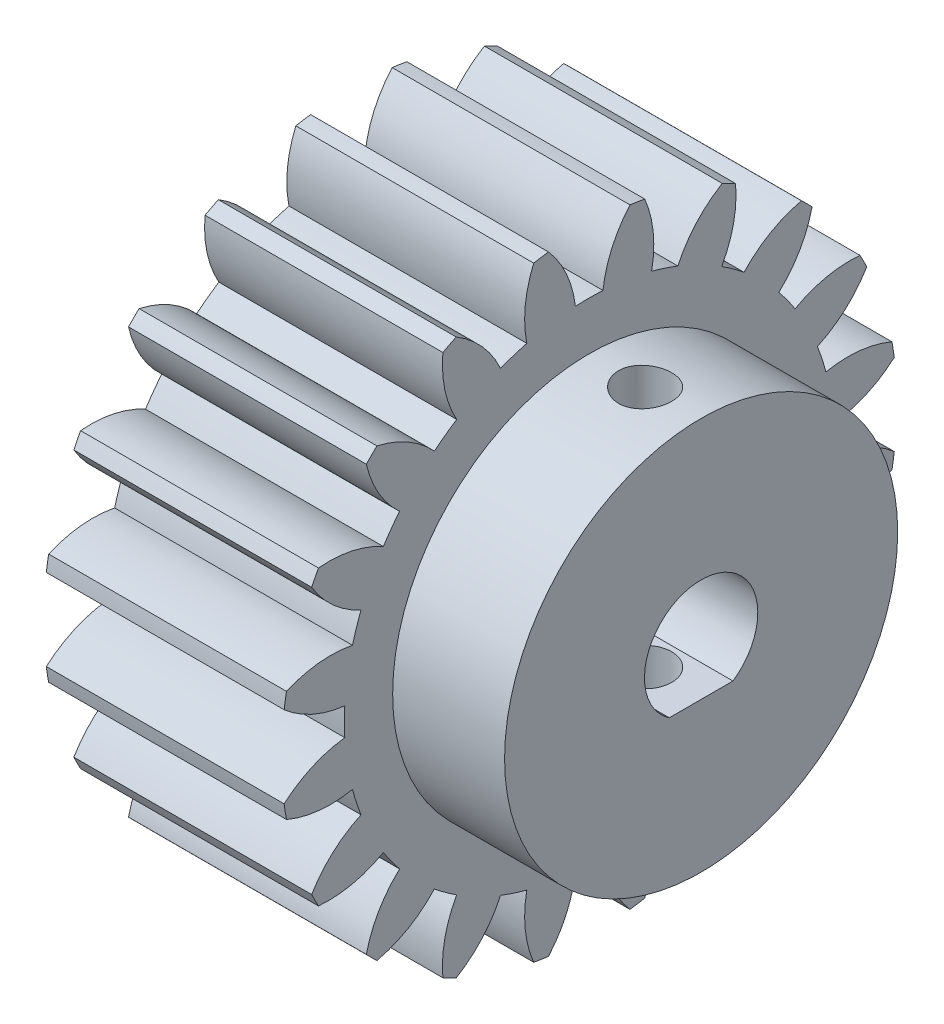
SolidWorks part; units mm, degrees
ref_plane "Plane1" through (0, 0, 0) normal (0, 0, 1) x (1, 0, 0)
ref_plane "Plane2" through (0, 0, 0) normal (0, 1, 0) x (1, 0, 0)
ref_plane "Plane3" through (0, 0, 0) normal (1, 0, 0) x (0, 0, -1)
other "Configuration Table"
sketch "HoldingSke" plane through (0, 0, 0) normal (0, 1, 0) x (1, 0, 0)
  line L0 (0, 0) -> (0.4698, -0.171)
  line L1 (-15, 0) -> (100, 0) construction
  line L2 (0, 0) -> (-2.1039, 2.3779)
  line L3 (0, 0) -> (-11.863, 4.5341)
  line L4 (0, 0) -> (8.1152, 2.9537)
  line L5 (0, 0) -> (-46.8476, -17.4728)
  line L6 (0, 0) -> (-14.0924, -9.5082)
  line L7 (-2.1039, 2.3779) -> (8.6586, 51.2059)
  line L8 (-76.2, 54.61) -> (-76.1, 54.61)
  line L9 (-71.009, 38.7566) -> (-53.1078, 45.2721)
  line L10 (-76.2, 71.12) -> (104.1128, 71.12)
  line L11 (0, 0) -> (-17, 0)
  line L12 (-76.2, 101.6) -> (-76.133, 101.6)
  line L13 (24.9733, 27.94) -> (52.9518, 28.4284)
  line L14 (24.9733, 27.94) -> (24.9743, 27.94)
  line L15 (24.9733, 27.94) -> (100.4006, 29.5858)
  line L16 (-63.627, -2) -> (-12.827, -2)
  circle A0 centre (0, 0) radius 0.4
  circle A1 centre (0, 0) radius 17.499
  circle A2 centre (0, 0) radius 37.5
  circle A3 centre (0, 0) radius 0.4
sketch "BasProSke" plane through (0, 0, 0) normal (0, 1, 0) x (1, 0, 0)
  line L0 (-10, 0) -> (60, 0) construction
  line L1 (0, 0) -> (0, 22)
  line L2 (0, 0) -> (17, 0)
  line L3 (17, 0) -> (17, 22)
  line L4 (17, 22) -> (0, 22)
revolve "Base-Revolve" add sketch "BasProSke" angle 360 about L0
sketch "TooCutSke" plane through (0, 0, 0) normal (1, 0, 0) x (0, 0, -1)
  line L1 (0, 0) -> (0, 107) construction
  line L2 (0, 0) -> (-1.6864, 19.9288) construction
  line L3 (0, 0) -> (-6.2409, 39.4033) construction
  line L4 (-1.6864, 19.9288) -> (-3.1204, 19.7016) construction
  arc A0 (0.9862, 17.4712) -> (-0.9862, 17.4712) centre (0, 0) ccw
  arc A1 (2.9329, 21.8293) -> (-2.9329, 21.8293) centre (0, 0) ccw
  circle A2 centre (0, 0) radius 20 construction
  circle A3 centre (0, 0) radius 18.7939 construction
  arc A4 (-0.9862, 17.4712) -> (-2.9329, 21.8293) centre (-8.9313, 16.536) ccw
  arc A5 (2.9329, 21.8293) -> (0.9862, 17.4712) centre (8.9313, 16.536) ccw
extrude "ToothCut" cut sketch "TooCutSke" along normal through all
fillet "Breaks" [suppressed] radius 0.04
fillet "RootFillets" [suppressed] radius 0.501
pattern_circular "TeethCuts" count 20 every 18 about axis through (-10, 0, 0) along (1, 0, 0) of "ToothCut", "RootFillets", "Breaks"
sketch "HubNeaOneSke" plane through (0, 0, 0) normal (-1, 0, 0) x (0, 0, 1)
  circle A0 centre (0, 0) radius 17.499
extrude "HubNearOne" [suppressed] add sketch "HubNeaOneSke" along normal blind 33.0001
sketch "HubNeaBotSke" plane through (0, 0, 0) normal (-1, 0, 0) x (0, 0, 1)
  circle A0 centre (0, 0) radius 17.499
extrude "HubNearBoth" [suppressed] add sketch "HubNeaBotSke" along normal blind 16.5
ref_plane "FarPln" through (17, 0, 0) normal (1, 0, 0) x (0, 0, -1)
sketch "HubFarSke" plane through (17, 0, 0) normal (1, 0, 0) x (0, 0, -1)
  circle A0 centre (0, 0) radius 17.499
extrude "HubFar" [suppressed] add sketch "HubFarSke" along normal blind 16.5
sketch "BorSke" plane through (0, 0, 0) normal (1, 0, 0) x (0, 0, -1)
  circle A0 centre (0, 0) radius 0.4
extrude "Bore" cut sketch "BorSke" along normal mid plane 100.0001
sketch "KeySke" plane through (0, 0, 0) normal (1, 0, 0) x (0, 0, -1)
  line L0 (-0.05, 0) -> (-0.05, 0.5)
  line L1 (-0.05, 0.5) -> (0.05, 0.5)
  line L2 (0.05, 0.5) -> (0.05, 0)
  line L3 (0, 0) -> (0, 34) construction
  line L4 (-0.05, 0) -> (0.05, 0)
extrude "Keyway" [suppressed] cut sketch "KeySke" along normal mid plane 100.0001
pattern_circular "Keyway2" [suppressed] count 2 every 90 about axis through (-10, 0, 0) along (1, 0, 0)
sketch "Croquis1" plane through (17, 0, 0) normal (1, 0, 0) x (0, 0, -1)
  line L0 (-2.276, -3.35) -> (2.276, -3.35)
  arc A0 (2.276, -3.35) -> (-2.276, -3.35) centre (0, 0) ccw
  point P5 (0, 4.05)
  dimension "D1" = 8.1
  dimension "D2" = 7.4
sketch "Croquis2" plane through (0, 0, 0) normal (-1, 0, 0) x (0, 0, 1)
  circle A0 centre (0, 0) radius 0.4
  circle A1 centre (0, 0) radius 0.4 construction
sketch "Croquis3" plane through (17, 0, 0) normal (1, 0, 0) x (0, 0, -1)
  line L0 (-2.276, -3.35) -> (2.276, -3.35) construction
  line L1 (-2.276, -3.35) -> (2.276, -3.35)
  circle A2 centre (0, 0) radius 14.05
  arc A3 (2.276, -3.35) -> (-2.276, -3.35) centre (0, 0) ccw construction
  arc A4 (2.276, -3.35) -> (-2.276, -3.35) centre (0, 0) ccw
  dimension "D1" = 28.1
extrude "Saliente-Extruir2" add sketch "Croquis3" along normal blind 8
sketch "Croquis4" plane through (0, 0, 0) normal (0, 1, 0) x (1, 0, 0)
  line L0 (0, 0) -> (25, 0) construction
  line L1 (0, 0.9862) -> (0, -0.9862) construction
  line L2 (25, -14.05) -> (25, 14.05) construction
  circle A0 centre (21, 0) radius 1.9
  dimension "D1" = 3.8
  dimension "D2" = 4
extrude "Cortar-Extruir2" cut sketch "Croquis4" against normal through all and the other way through all
extrude "Cortar-Extruir3" cut sketch "Croquis1" against normal blind 10 contours A0 L0
equation "' \"Module@HoldingSke\" = 6.35"
equation "' \"Num_teeth@HoldingSke\" = 12"
equation "' \"Ap@HoldingSke\" =  20"
equation "' \"Ap@HoldingSke\" = 20"
equation "' \"Width@HoldingSke\" = 0.5 * 25.4"
equation "' \"Hub_dia@HoldingSke\"= 1 * 25.4"
equation "' \"Hub_dia@HoldingSke\" = 1 * 25.4"
equation "' \"Overall_len@HoldingSke\" = 1.0 * 25.4"
equation "' \"Bore@HoldingSke\" = 0.75 * 25.4"
equation "' \"T_dim@HoldingSke\" = 0.1 * 25.4"
equation "' \"Width@KeySke\" = 0.25 * 25.4"
equation "' \"Show_teeth@HoldingSke\" = 13"
equation "' \"Backlash@HoldingSke\" = 0.009 * 25.4"
equation "' \"Addendum_fac@HoldingSke\" = 1.0"
equation "' \"Dedendum_fac@HoldingSke\" = 1.25"
equation "' \"Dedendum_add@HoldingSke\" = 0.00005 * 25.4"
equation "' \"Clearance_fac@HoldingSke\" = 0.25"
equation "\"Pitch@HoldingSke\" = 1 / \"Module@HoldingSke\""
equation "\"Overcut_dia@TooCutSke\" = (\"Num_teeth@HoldingSke\" + 2 * \"Addendum_fac@HoldingSke\") / \"Pitch@HoldingSke\" + 0.002 * 25.4"
equation "\"Pitch_dia@TooCutSke\" = \"Num_teeth@HoldingSke\" / \"Pitch@HoldingSke\""
equation "\"Base_dia@TooCutSke\" = \"Num_teeth@HoldingSke\" / \"Pitch@HoldingSke\" * cos((\"Ap@HoldingSke\"  * 3.14159265 / 180))"
equation "\"Root_dia@TooCutSke\" = (\"Num_teeth@HoldingSke\" + 2) / \"Pitch@HoldingSke\" - 2 * (\"Addendum_fac@HoldingSke\" + \"Dedendum_fac@HoldingSke\") / \"Pitch@HoldingSke\" - \"Dedendum_add@HoldingSke\" * 2"
equation "\"Half_ang@TooCutSke\" = 180 / \"Num_teeth@HoldingSke\""
equation "\"Half_CT@TooCutSke\" = \"Num_teeth@HoldingSke\" / \"Pitch@HoldingSke\" * sin((3.14159265 / 2 / \"Num_teeth@HoldingSke\")) / 2 - 7 * \"Backlash@HoldingSke\" / 4"
equation "\"Flank_rad@TooCutSke\" = \"Num_teeth@HoldingSke\" / \"Pitch@HoldingSke\" / 5"
equation "\"Radius@RootFillets\" = \"Clearance_fac@HoldingSke\" / \"Pitch@HoldingSke\" + \"Dedendum_add@HoldingSke\""
equation "\"Break_rad@Breaks\" = 0.02 / \"Pitch@HoldingSke\""
equation "\"Thickness@HoldingSke\" = \"Width@HoldingSke\""
equation "\"OAL@HoldingSke\" = \"Thickness@HoldingSke\""
equation "\"MHD@HoldingSke\" = (\"Num_teeth@HoldingSke\" + 2) / \"Pitch@HoldingSke\" - 2 * (\"Addendum_fac@HoldingSke\" + \"Dedendum_fac@HoldingSke\")  / \"Pitch@HoldingSke\" - \"Dedendum_add@HoldingSke\" * 2"
equation "\"MBD@HoldingSke\" = (\"Num_teeth@HoldingSke\" + 2) / \"Pitch@HoldingSke\" - 2 * (\"Addendum_fac@HoldingSke\" + \"Dedendum_fac@HoldingSke\")  / \"Pitch@HoldingSke\" - \"Dedendum_add@HoldingSke\" * 2 - 0.002 * 25.4"
equation "\"MHD@HoldingSke\" = ((sgn( \"MHD@HoldingSke\" - \"Hub_dia@HoldingSke\" )-1)*( \"MHD@HoldingSke\" - \"Hub_dia@HoldingSke\" ))/-2+ \"Hub_dia@HoldingSke\""
equation "\"MBD@HoldingSke\" = ((sgn( \"MBD@HoldingSke\" - \"Bore@HoldingSke\" )-1)*( \"MBD@HoldingSke\" - \"Bore@HoldingSke\" ))/-2+ \"Bore@HoldingSke\""
equation "\"OAL@HoldingSke\" = ((sgn( \"OAL@HoldingSke\" - \"Overall_len@HoldingSke\" )+1)*( \"OAL@HoldingSke\" - \"Overall_len@HoldingSke\" ))/2 + \"Overall_len@HoldingSke\" + 0.000002 * 25.4"
equation "\"Num_teeth@TeethCuts\" = int( \"Show_teeth@HoldingSke\" ) + 1"
equation "\"Num_teeth@TeethCuts\" = ((sgn( \"Num_teeth@TeethCuts\" - \"Num_teeth@HoldingSke\" )-1)*( \"Num_teeth@TeethCuts\" - \"Num_teeth@HoldingSke\" ))/-2+ \"Num_teeth@HoldingSke\""
equation "\"Num_teeth@TeethCuts\" = ((sgn( \"Num_teeth@TeethCuts\" - 2.0)+1)*( \"Num_teeth@TeethCuts\" - 2.0))/2 +2.0"
equation "\"Angle@TeethCuts\" = 360.0 / \"Num_teeth@HoldingSke\""
equation "\"Diameter@BasProSke\" = (\"Num_teeth@HoldingSke\" + 2 * \"Addendum_fac@HoldingSke\") / \"Pitch@HoldingSke\""
equation "\"Thickness@BasProSke\"  = \"Thickness@HoldingSke\""
equation "' \"Fillet_rad@BasProSke\" =  \"Thickness@HoldingSke\" * 0.05"
equation "' \"Fillet_rad@BasProSke\" = \"Thickness@HoldingSke\" * 0.05"
equation "\"MHD@HoldingSke\" = ((sgn( \"MHD@HoldingSke\" - \"Root_dia@TooCutSke\" )-1)*( \"MHD@HoldingSke\" - \"Root_dia@TooCutSke\" ))/-2+ \"Root_dia@TooCutSke\""
equation "\"Diameter@HubNeaOneSke\" = \"MHD@HoldingSke\""
equation "\"Length@HubNearOne\" = \"OAL@HoldingSke\" - \"Thickness@BasProSke\""
equation "\"Diameter@HubNeaBotSke\" = \"MHD@HoldingSke\""
equation "\"Length@HubNearBoth\" = ( \"OAL@HoldingSke\" - \"Thickness@BasProSke\" ) / 2.0"
equation "\"Thickness@FarPln\" = \"Thickness@BasProSke\""
equation "\"Diameter@HubFarSke\" = \"MHD@HoldingSke\""
equation "\"Length@HubFar\" = ( \"OAL@HoldingSke\" - \"Thickness@BasProSke\" ) / 2.0"
equation "\"Diameter@BorSke\" = \"MBD@HoldingSke\""
equation "\"D1@Bore\" = \"OAL@HoldingSke\" * 2.0"
equation "\"D1@Keyway\" = \"OAL@HoldingSke\" * 2.0"
equation "\"Offset@KeySke\" = \"T_dim@HoldingSke\" + \"MBD@HoldingSke\" / 2.0"
